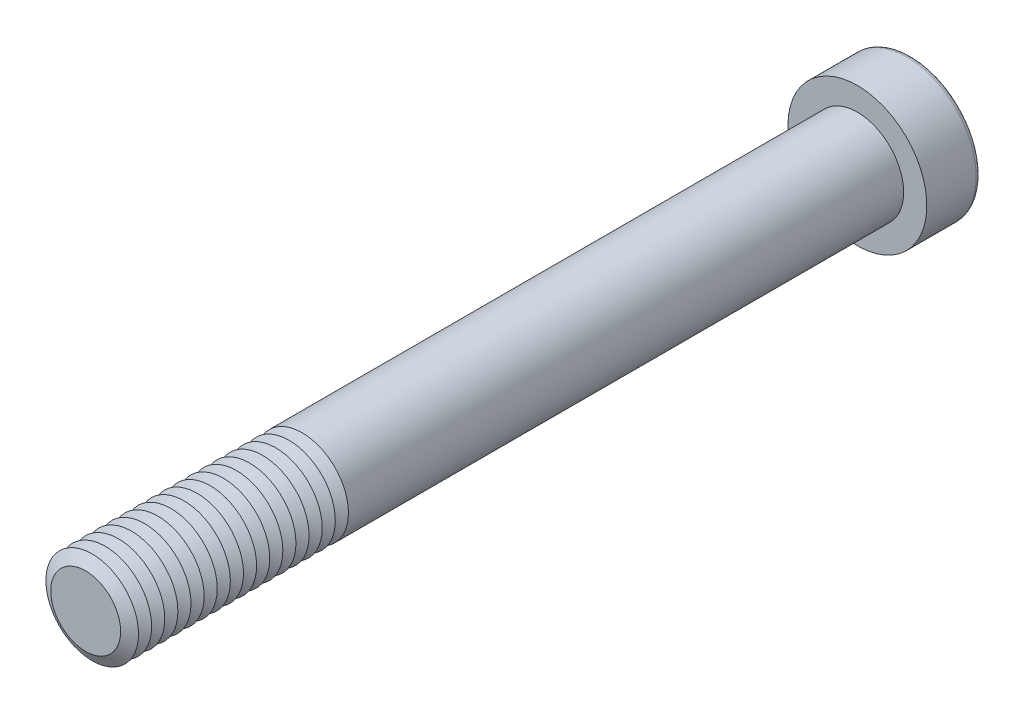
SolidWorks part; units mm, degrees
ref_plane "Front Plane" through (0, 0, 0) normal (0, 0, 1) x (1, 0, 0)
ref_plane "Top Plane" through (0, 0, 0) normal (0, 1, 0) x (1, 0, 0)
ref_plane "Right Plane" through (0, 0, 0) normal (1, 0, 0) x (0, 0, -1)
sketch "Sketch1" plane through (0, 0, 0) normal (0, 0, 1) x (1, 0, 0)
  circle A0 centre (0, 0) radius 6
  dimension "D1" = 12
extrude "Boss-Extrude1" add sketch "Sketch1" along normal blind 100
sketch "Sketch2" plane through (0, 0, 0) normal (0, 0, -1) x (-1, 0, 0)
  circle A0 centre (0, 0) radius 9
  dimension "D1" = 18
extrude "Boss-Extrude2" add sketch "Sketch2" along normal blind 7
sketch "Sketch3" plane through (0, 0, -7) normal (0, 0, -1) x (-1, 0, 0)
  line L1 (-2.3094, 4) -> (-4.6188, 0)
  line L2 (-4.6188, 0) -> (-2.3094, -4)
  line L3 (-2.3094, -4) -> (2.3094, -4)
  line L4 (2.3094, -4) -> (4.6188, 0)
  line L5 (4.6188, 0) -> (2.3094, 4)
  line L6 (2.3094, 4) -> (-2.3094, 4)
  circle A0 centre (0, 0) radius 4 construction
  dimension "D1" = 8
extrude "Cut-Extrude1" cut sketch "Sketch3" against normal blind 6
fillet "Fillet1" radius 0.6 1 edges at (-9, 0, -7)
sketch "Sketch4" plane through (0, 0, -1) normal (0, 0, -1) x (-1, 0, 0)
  line L0 (2.3094, -4) -> (4.6188, 0) construction
  circle A0 centre (0, 0) radius 4
extrude "Cut-Extrude2" cut sketch "Sketch4" against normal through all draft 60
sketch "Sketch5" plane through (0, 0, -7) normal (0, 0, -1) x (-1, 0, 0)
  circle A0 centre (0, 0) radius 4.6188
extrude "Cut-Extrude3" cut sketch "Sketch5" against normal through all draft 75
sketch "Sketch7" plane through (0, 0, 0) normal (1, 0, 0) x (0, 0, -1)
  line L25 (-100, 4.5278) -> (-99.15, 6)
  line L26 (-100, 6) -> (-100, -6) construction
  line L27 (-99.15, 6) -> (-100.85, 6)
  line L28 (-100.85, 6) -> (-100, 4.5278)
  line L29 (0, 6) -> (-100, 6) construction
  dimension "D1" = 1.7
revolve "Cut-Revolve1" cut sketch "Sketch7" angle 360 about axis through (0, 0, 100) along (0, 0, -1)
pattern_linear "LPattern1" count 17 spacing 1.7 along (0, 0, -1) of "Cut-Revolve1"
